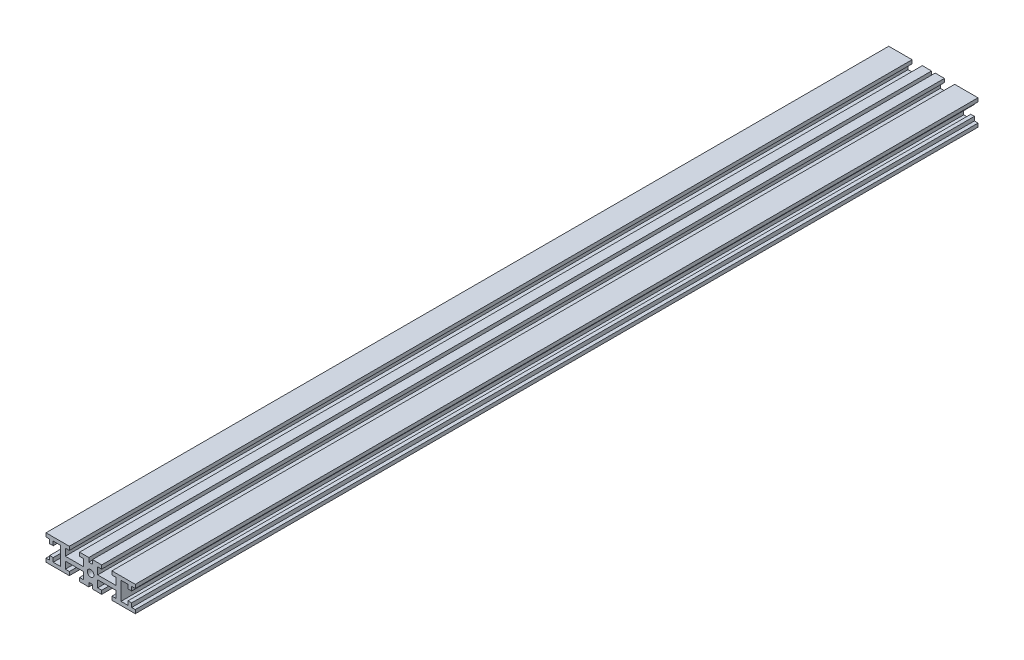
SolidWorks part; units mm, degrees
ref_plane "Front Plane" through (0, 0, 0) normal (0, 0, 1) x (1, 0, 0)
ref_plane "Top Plane" through (0, 0, 0) normal (0, 1, 0) x (1, 0, 0)
ref_plane "Right Plane" through (0, 0, 0) normal (1, 0, 0) x (0, 0, -1)
sketch "Sketch1" plane through (0, 0, 0) normal (0, 0, 1) x (1, 0, 0)
  line L0 (5.5, 6.35) -> (-5.5, 6.35)
  line L1 (-10.6, 6.35) -> (-22.225, 6.35)
  line L2 (-5.5, -6.35) -> (5.5, -6.35)
  line L3 (-3.5, 1.05) -> (-12.6, 1.05)
  line L4 (-20.425, 2.55) -> (-20.425, 4.55)
  line L5 (-3.5, -1.05) -> (-12.6, -1.05)
  line L6 (0, -6.35) -> (0, 6.35) construction
  line L7 (3.5, 4.55) -> (3.5, 1.05)
  line L8 (12.6, 1.05) -> (12.6, 4.55)
  line L9 (5.5, -4.55) -> (3.5, -4.55)
  line L10 (22.225, -6.35) -> (10.6, -6.35)
  line L11 (-12.6, 4.55) -> (-10.6, 4.55)
  line L12 (12.6, -1.05) -> (12.6, -4.55)
  line L13 (-10.6, 4.55) -> (-10.6, 6.35)
  line L14 (5.5, -4.55) -> (5.5, -6.35)
  line L15 (-15.125, 4.55) -> (-18.625, 4.55)
  line L16 (10.6, -4.55) -> (10.6, -6.35)
  line L17 (3.5, -4.55) -> (3.5, -1.05)
  line L18 (12.6, -4.55) -> (10.6, -4.55)
  line L19 (20.425, -2.55) -> (20.425, -4.55)
  line L20 (18.625, 2.55) -> (20.425, 2.55)
  line L21 (-3.5, 4.55) -> (-5.5, 4.55)
  line L22 (18.625, -2.55) -> (20.425, -2.55)
  line L23 (-5.5, 4.55) -> (-5.5, 6.35)
  line L24 (15.125, 4.55) -> (15.125, -4.55)
  line L25 (18.625, -4.55) -> (15.125, -4.55)
  line L26 (18.625, -4.55) -> (18.625, -2.55)
  line L27 (18.625, 4.55) -> (18.625, 2.55)
  line L28 (5.5, 4.55) -> (5.5, 6.35)
  line L29 (3.5, 4.55) -> (5.5, 4.55)
  line L30 (15.125, 4.55) -> (18.625, 4.55)
  line L31 (-18.625, 4.55) -> (-18.625, 2.55)
  line L32 (-18.625, -4.55) -> (-18.625, -2.55)
  line L33 (-18.625, -4.55) -> (-15.125, -4.55)
  line L34 (-15.125, 4.55) -> (-15.125, -4.55)
  line L35 (-18.625, -2.55) -> (-20.425, -2.55)
  line L36 (-18.625, 2.55) -> (-20.425, 2.55)
  line L37 (10.6, 4.55) -> (10.6, 6.35)
  line L38 (-20.425, 4.55) -> (-22.225, 4.55)
  line L39 (12.6, 4.55) -> (10.6, 4.55)
  line L40 (3.5, -1.05) -> (12.6, -1.05)
  line L41 (-12.6, -4.55) -> (-10.6, -4.55)
  line L42 (20.425, -4.55) -> (22.225, -4.55)
  line L43 (3.5, 1.05) -> (12.6, 1.05)
  line L44 (10.6, 6.35) -> (22.225, 6.35)
  line L45 (-22.225, -6.35) -> (-22.225, -4.55)
  line L46 (-3.5, -4.55) -> (-3.5, -1.05)
  line L47 (-22.225, 6.35) -> (-22.225, 4.55)
  line L48 (-10.6, -4.55) -> (-10.6, -6.35)
  line L49 (-20.425, -2.55) -> (-20.425, -4.55)
  line L50 (-5.5, -4.55) -> (-5.5, -6.35)
  line L51 (-20.425, -4.55) -> (-22.225, -4.55)
  line L52 (22.225, -4.55) -> (22.225, -6.35)
  line L53 (20.425, 2.55) -> (20.425, 4.55)
  line L54 (20.425, 4.55) -> (22.225, 4.55)
  line L55 (-12.6, -1.05) -> (-12.6, -4.55)
  line L56 (22.225, 4.55) -> (22.225, 6.35)
  line L57 (-22.225, -6.35) -> (-10.6, -6.35)
  line L59 (-5.5, -4.55) -> (-3.5, -4.55)
  line L63 (-12.6, 1.05) -> (-12.6, 4.55)
  line L65 (-3.5, 4.55) -> (-3.5, 1.05)
  point P14 (-5.5, -5.45)
  point P15 (-10.6, -5.45)
  dimension "D11" = 6.35
  dimension "D16" = 2
  dimension "D6" = 12.7
  dimension "D8" = 5.5
  dimension "D5" = 1.8
  dimension "D7" = 5.1
  dimension "D9" = 5.5
  dimension "D10" = 3.5
  dimension "D12" = 2
  dimension "D13" = 1.8
  dimension "D14" = 44.45
  dimension "D15" = 1.8
  dimension "D17" = 3.5
  dimension "D18" = 1.8
  dimension "D19" = 2
  dimension "D20" = 1.8
  dimension "D22" = 2
  dimension "D23" = 1.8
  dimension "D26" = 2
  dimension "D27" = 2
  dimension "D29" = 3.5
  dimension "D33" = 9.1
  dimension "D41" = 1.8
extrude "Boss-Extrude1" add sketch "Sketch1" along normal blind 419.6
sketch "Sketch2" plane through (0, 0, 419.6) normal (0, 0, 1) x (1, 0, 0)
  circle A1 centre (0, 0) radius 2
  dimension "D3" = 4
hole_wizard "M4 Tapped Hole1" positions "3DSketch1" profile "Sketch3" tap size "M4" standard "DIN"
sketch3d "3DSketch1"
  point P0 (0, 0, 419.6)
sketch "Sketch3" plane through (0, 0, 419.6) normal (1, 0, 0) x (0, -1, 0)
  line L0 (0, 0) -> (0, 419.6)
  line L1 (0, 419.6) -> (1.65, 419.6)
  line L2 (1.65, 419.6) -> (1.65, 0)
  line L5 (1.65, 0) -> (0, 0)
  line L11 (0, -6.35) -> (0, 107.95) construction
  dimension "Thru Tap Drill Dia." = 3.3
  dimension "Thru Tap Drill Depth" = 419.6
sketch "Sketch5" plane through (0, 0, 419.6) normal (0, 0, 1) x (1, 0, 0)
  line L2 (-0.9, -6.35) -> (0.9, -6.35)
  line L3 (-0.9, -6.35) -> (-0.9, -4.35)
  line L4 (-0.9, -4.35) -> (0.9, -4.35)
  line L5 (0.9, -6.35) -> (0.9, -4.35)
  line L6 (0.9, 6.35) -> (-0.9, 6.35)
  line L7 (0.9, 6.35) -> (0.9, 4.35)
  line L8 (0.9, 4.35) -> (-0.9, 4.35)
  line L9 (-0.9, 6.35) -> (-0.9, 4.35)
  line L11 (-5.5, -6.35) -> (5.5, -6.35) construction
  line L22 (5.5, 6.35) -> (-5.5, 6.35) construction
  point P4 (0, 4.35)
  dimension "D1" = 1.8
  dimension "D2" = 2
  dimension "D3" = 2
  dimension "D6" = 1.8
extrude "Cut-Extrude1" cut sketch "Sketch5" against normal through all
